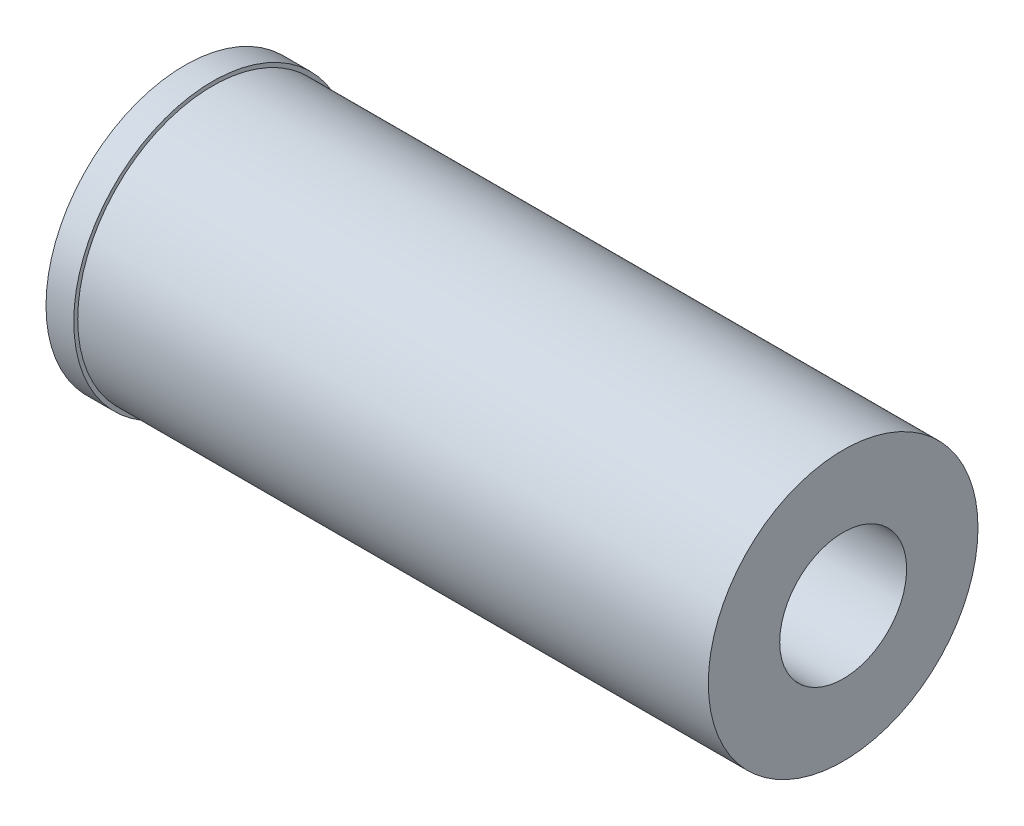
SolidWorks part; units mm, degrees
ref_plane "Face" through (0, 0, 0) normal (0, 0, 1) x (1, 0, 0)
ref_plane "Dessus" through (0, 0, 0) normal (0, 1, 0) x (1, 0, 0)
ref_plane "Droite" through (0, 0, 0) normal (1, 0, 0) x (0, 0, -1)
sketch "Esquisse1" plane through (0, 0, 0) normal (0, 0, 1) x (1, 0, 0)
  line L0 (0, 0) -> (61.7463, 0) construction
  line L1 (0, 0) -> (0, 3.5)
  line L2 (0, 3.5) -> (0.7, 3.5)
  line L3 (0.7, 3.5) -> (0.7, 3.4)
  line L4 (0.7, 3.4) -> (16.6, 3.4)
  line L5 (16.6, 3.4) -> (16.6, 1.6)
  line L6 (16.6, 1.6) -> (1.5, 1.6)
  line L7 (1.5, 1.6) -> (1.5, 0.8)
  line L8 (1.5, 0.8) -> (0.7, 0.8)
  line L9 (0.7, 0.8) -> (0.7, 0)
  line L10 (0.7, 0) -> (0, 0)
  dimension "D1" = 0.8
  dimension "D2" = 0.7
  dimension "D3" = 0.8
  dimension "D4" = 3.5
  dimension "D5" = 0.1
  dimension "D6" = 15.9
  dimension "D7" = 0.8
revolve "Révolution1" add sketch "Esquisse1" angle 360 about L0
